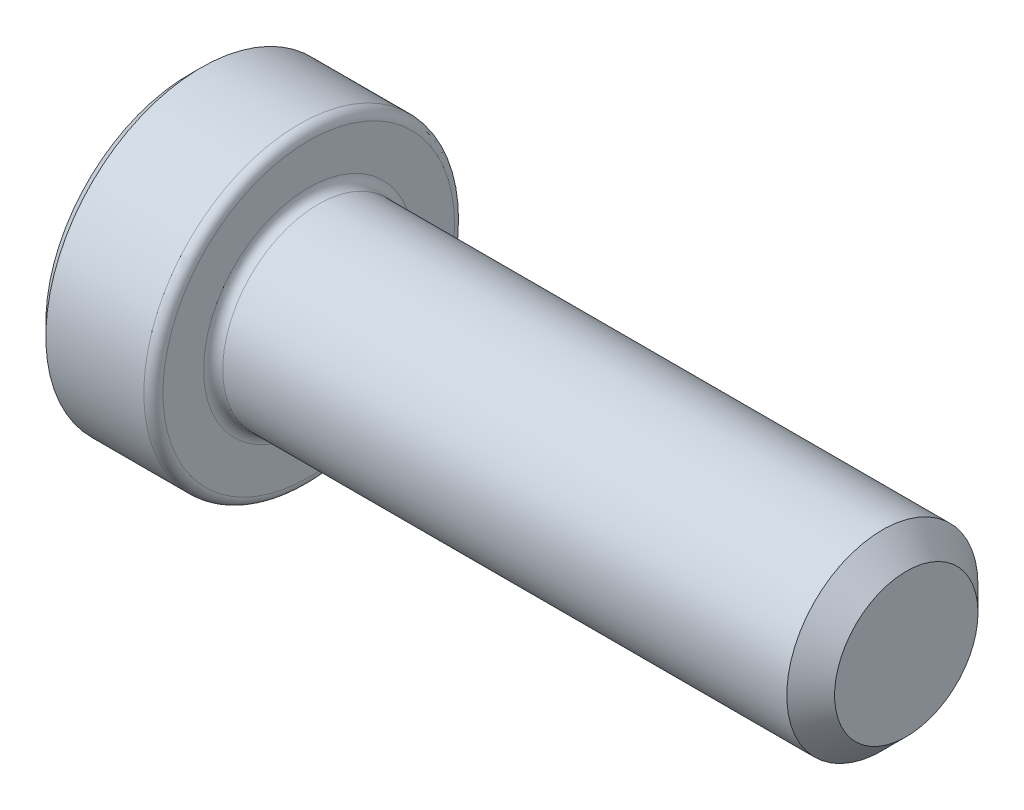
SolidWorks part; units mm, degrees
ref_plane "Ebene vorne" through (0, 0, 0) normal (0, 0, 1) x (1, 0, 0)
ref_plane "Ebene oben" through (0, 0, 0) normal (0, 1, 0) x (1, 0, 0)
ref_plane "Ebene rechts" through (0, 0, 0) normal (1, 0, 0) x (0, 0, -1)
sketch "Skizze1" plane through (0, 0, 0) normal (0, 0, -1) x (-1, 0, 0)
  line L0 (0, 0) -> (48.7358, 0) construction
  line L1 (30, 0) -> (30, 6)
  line L9 (30, 0) -> (0, 0)
  line L10 (0, 3) -> (1, 4)
  line L11 (30, 6) -> (29.5, 6.5)
  line L12 (0, 3) -> (0, 0)
  line L13 (24.6, 4) -> (1, 4)
  line L14 (25, 6.1) -> (25, 4.4)
  line L15 (25.4, 6.5) -> (29.5, 6.5)
  arc A0 (25, 6.1) -> (25.4, 6.5) centre (25.4, 6.1) cw
  arc A1 (24.6, 4) -> (25, 4.4) centre (24.6, 4.4) ccw
  dimension "D9" = 13
  dimension "D7" = 0.4
  dimension "D8" = 8
  dimension "D1" = 5
  dimension "D2" = 25
  dimension "D3" = 1
  dimension "D4" = 45
  dimension "D5" = 45
  dimension "D6" = 0.5
revolve "Rotation1" add sketch "Skizze1" angle 360 about L0
sketch "Skizze2" plane through (-30, 0, 0) normal (-1, 0, 0) x (0, 0, 1)
  line L0 (-1.7321, 3) -> (1.7321, 3)
  line L1 (1.7321, 3) -> (3.4641, 0)
  line L2 (3.4641, 0) -> (1.7321, -3)
  line L3 (1.7321, -3) -> (-1.7321, -3)
  line L4 (-1.7321, -3) -> (-3.4641, 0)
  line L5 (-3.4641, 0) -> (-1.7321, 3)
  line L6 (-6.0311, 0) -> (5.8663, 0) construction
  line L7 (0, 5.9466) -> (0, -5.1312) construction
  line L8 (0, 3) -> (0, 2.8509) construction
  circle A0 centre (0, 0) radius 3.4641 construction
  dimension "D1" = 3
extrude "Schnitt-Linear austragen1" cut sketch "Skizze2" against normal blind 3
chamfer "Fase2" distance 2 angle 30 6 edges at (-27, -1.5, 2.5981) (-27, -3, 0) (-27, -1.5, -2.5981) (-27, 1.5, 2.5981) (-27, 3, 0) (-27, 1.5, -2.5981)
